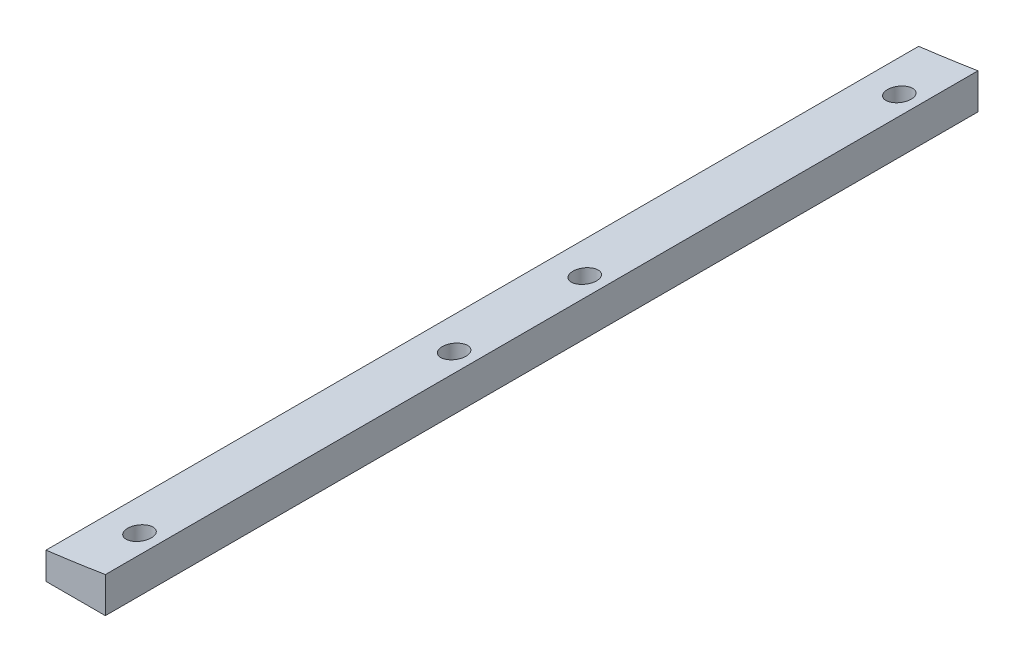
SolidWorks part; units mm, degrees
ref_plane "s1" through (0, 0, 0) normal (0, 0, 1) x (1, 0, 0)
ref_plane "Dessus" through (0, 0, 0) normal (0, 1, 0) x (1, 0, 0)
ref_plane "Droite" through (0, 0, 0) normal (1, 0, 0) x (0, 0, -1)
sketch "Esquisse1" plane through (0, 0, 0) normal (0, 0, 1) x (1, 0, 0)
  line L0 (0, 60) -> (0, -20) construction
  line L6 (75, -14.6009) -> (95, -14.6009)
  line L7 (95, -2.6009) -> (95, -14.6009)
  line L8 (75, -5.4636) -> (75, -14.6009)
  arc A2 (75, -5.4636) -> (95, -2.6009) centre (0, 589.8305) ccw
  point P6 (0, -2.3874)
  dimension "D3" = 600
  dimension "D1" = 20
  dimension "D2" = 95
  dimension "D4" = 12
  dimension "D5" = 75
extrude "Extrusion1" add sketch "Esquisse1" along normal blind 294
hole_wizard "Diamètre du perçage Ø8.0 (8)1" positions "Esquisse3" profile "Esquisse4" hole size "Ø8.0" standard "ISO"
sketch "Esquisse3" plane through (0, -14.6009, 0) normal (0, -1, 0) x (1, 0, 0)
  line L1 (87.5, 303.8738) -> (87.5, -7.1055) construction
  line L2 (95, 294) -> (95, 0) construction
  line L3 (75, 294) -> (95, 294) construction
  line L4 (75, 0) -> (95, 0) construction
  point P0 (87.5, 169)
  point P12 (87.5, 19)
  point P18 (87.5, 275)
  point P20 (87.5, 125)
  dimension "D1" = 7.5
  dimension "D2" = 125
  dimension "D3" = 19
  dimension "D4" = 19
  dimension "D5" = 125
sketch "Esquisse4" plane through (87.5, -14.6009, 169) normal (1, 0, 0) x (0, 0, -1)
  line L0 (0, 0) -> (0, 12)
  line L1 (0, 12) -> (4, 12)
  line L2 (4, 12) -> (4, 0)
  line L5 (4, 0) -> (0, 0)
  line L11 (0, -6.35) -> (0, 107.95) construction
  dimension "Diamètre du perçage jusqu'au prochain" = 8
  dimension "Profondeur du perçage jusqu'au prochain" = 12
